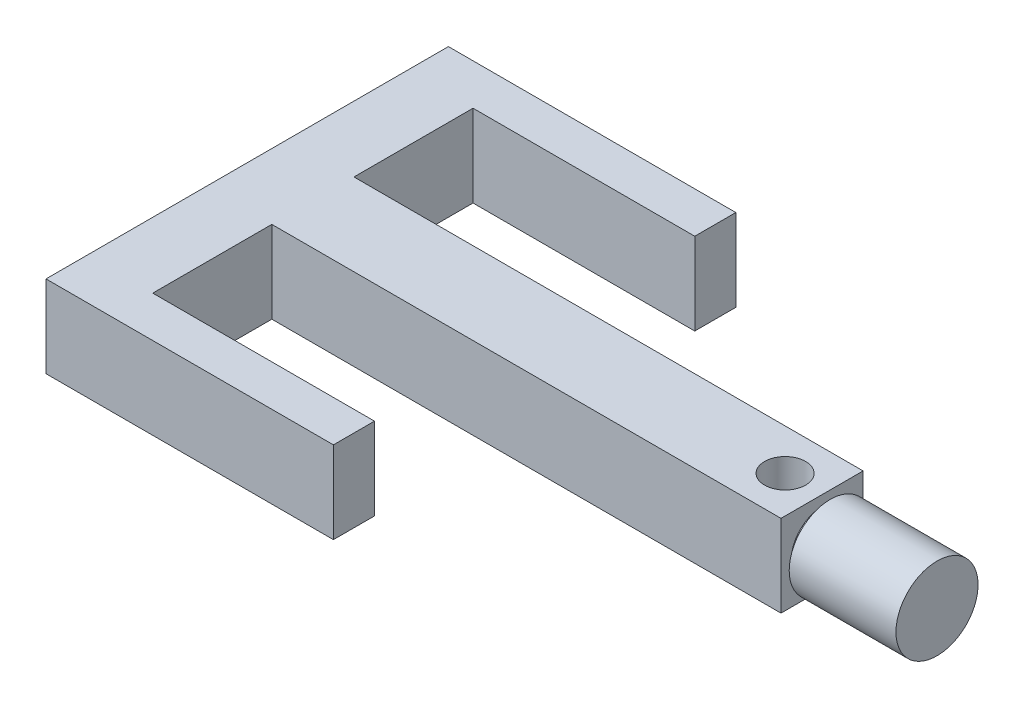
SolidWorks part; units mm, degrees
ref_plane "Piano frontale" through (0, 0, 0) normal (0, 0, 1) x (1, 0, 0)
ref_plane "Piano superiore" through (0, 0, 0) normal (0, 1, 0) x (1, 0, 0)
ref_plane "Piano destro" through (0, 0, 0) normal (1, 0, 0) x (0, 0, -1)
sketch "Schizzo2" plane through (0, 0, 0) normal (0, 1, 0) x (1, 0, 0)
  line L0 (0, 0) -> (0, 98)
  line L1 (0, 98) -> (70, 98)
  line L2 (70, 98) -> (70, 88)
  line L3 (70, 88) -> (16, 88)
  line L4 (16, 88) -> (16, 59)
  line L5 (16, 59) -> (140, 59)
  line L6 (140, 59) -> (140, 39)
  line L7 (140, 39) -> (16, 39)
  line L8 (16, 39) -> (16, 10)
  line L9 (16, 10) -> (70, 10)
  line L10 (70, 10) -> (70, 0)
  line L11 (70, 0) -> (0, 0)
  dimension "D1" = 98
  dimension "D2" = 124
  dimension "D3" = 10
  dimension "D4" = 10
  dimension "D5" = 20
  dimension "D6" = 16
  dimension "D7" = 70
  dimension "50" = 70
  dimension "D8" = 29
  dimension "D9" = 29
  dimension "D10" = 140
extrude "Estrusione-Estrusione1" add sketch "Schizzo2" along normal blind 20
sketch "Schizzo3" plane through (140, 0, 0) normal (1, 0, 0) x (0, 0, -1)
  line L0 (39, 20) -> (59, 20) construction
  line L1 (39, 20) -> (39, 0) construction
  circle A0 centre (49, 10) radius 7.5
  dimension "D3" = 15
  dimension "D1" = 10
  dimension "D2" = 10
extrude "Estrusione-Estrusione2" add sketch "Schizzo3" along normal blind 2
sketch "Schizzo4" plane through (142, 0, 0) normal (1, 0, 0) x (0, 0, -1)
  circle A0 centre (49, 10) radius 10
  circle A2 centre (49, 10) radius 7.5 construction
  dimension "D1" = 20
extrude "Estrusione-Estrusione3" add sketch "Schizzo4" along normal blind 26
sketch "Schizzo6" plane through (0, 20, 0) normal (0, 1, 0) x (1, 0, 0)
  line L1 (140, 39) -> (140, 59) construction
  circle A0 centre (131, 49) radius 5
  dimension "D1" = 9
extrude "Taglio-Estrusione1" cut sketch "Schizzo6" against normal blind 23
